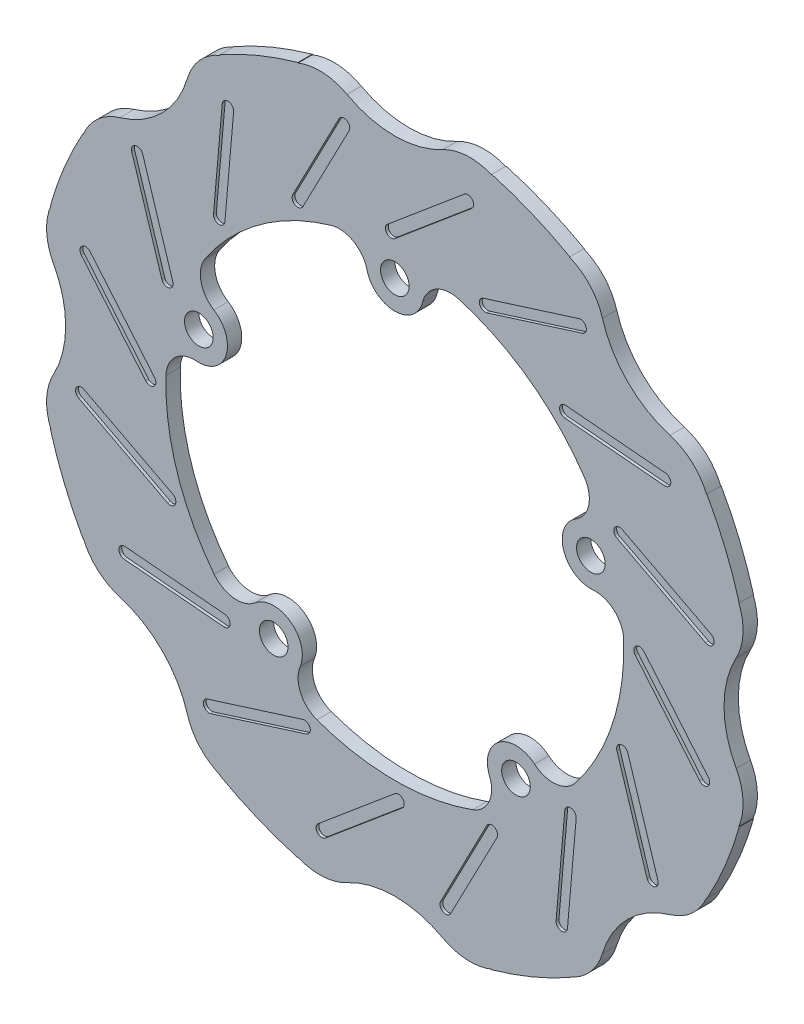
SolidWorks part; units mm, degrees
ref_plane "Front Plane" through (0, 0, 0) normal (0, 0, 1) x (1, 0, 0)
ref_plane "Top Plane" through (0, 0, 0) normal (0, 1, 0) x (1, 0, 0)
ref_plane "Right Plane" through (0, 0, 0) normal (1, 0, 0) x (0, 0, -1)
sketch "Sketch1" plane through (0, 0, 0) normal (0, 0, 1) x (1, 0, 0)
  line L0 (0, 125) -> (0, 0) construction
  line L1 (0, 0) -> (125, 0) construction
  circle A0 centre (0, 0) radius 125
  circle A1 centre (0, 0) radius 80
  dimension "OD" = 250
  dimension "ID" = 160
extrude "Boss-Extrude1" add sketch "Sketch1" against normal blind 5
sketch "Sketch5" plane through (0, 0, 0) normal (0, 0, 1) x (1, 0, 0)
  line L0 (0, 0) -> (0, 125) construction
  line L1 (33.8556, 120.1627) -> (33.8556, 137)
  line L2 (-33.8556, 120.1627) -> (-33.8556, 137)
  line L3 (-33.8556, 137) -> (33.8556, 137)
  circle A0 centre (0, 0) radius 125 construction
  arc A1 (-16.7024, 119.2424) -> (16.7024, 119.2424) centre (0, 150) ccw
  arc A3 (16.7024, 119.2424) -> (33.8556, 120.1627) centre (26.2467, 101.6667) cw
  arc A4 (-16.7024, 119.2424) -> (-33.8556, 120.1627) centre (-26.2467, 101.6667) ccw
  circle A5 centre (0, 0) radius 125 construction
  point P12 (30, 121.3466)
  dimension "D1" = 35
  dimension "D3" = 20
  dimension "D2" = 60
  dimension "D4" = 12
  dimension "D5" = 25
extrude "Cut-Extrude1" cut sketch "Sketch5" against normal through all contours L3 L1 A3 A1 A4 L2
pattern_circular "CirPattern1" [suppressed] count 6 over 360
sketch "Sketch6" plane through (0, 0, 0) normal (0, 0, 1) x (1, 0, 0)
  line L0 (0, 0) -> (0, 80) construction
  circle A0 centre (0, 0) radius 80 construction
  arc A1 (-9.7139, 69.625) -> (9.7139, 69.625) centre (0, 72) ccw
  arc A2 (-22.2031, 76.8571) -> (22.2031, 76.8571) centre (0, 0) ccw construction
  arc A3 (-22.2031, 76.8571) -> (-9.7139, 69.625) centre (-19.4278, 67.25) cw
  arc A4 (22.2031, 76.8571) -> (9.7139, 69.625) centre (19.4278, 67.25) ccw
  arc A5 (22.2031, 76.8571) -> (-22.2031, 76.8571) centre (0, 0) ccw
  dimension "D1" = 8
  dimension "IS_Dia" = 20
  dimension "D2" = 10
extrude "Boss-Extrude2" add sketch "Sketch6" against normal up to surface (5 mm away)
hole_wizard "Ø10.0 (10) Diameter Hole1" positions "Sketch7" profile "Sketch8" hole size "Ø10.0" standard "ANSI Metric"
sketch "Sketch7" plane through (0, 0, 0) normal (0, 0, 1) x (1, 0, 0)
  point P0 (0, 72)
sketch "Sketch8" plane through (0, 72, 0) normal (1, 0, 0) x (0, -1, 0)
  line L0 (0, 0) -> (0, 5)
  line L1 (0, 5) -> (5, 5)
  line L2 (5, 5) -> (5, 0)
  line L5 (5, 0) -> (0, 0)
  line L11 (0, -6.35) -> (0, 107.95) construction
  dimension "Thru Hole Dia." = 10
  dimension "Thru Hole Depth" = 5
sketch "Sketch9" plane through (0, 0, 0) normal (0, 0, 1) x (1, 0, 0)
  arc A0 (26.0924, 85.4387) -> (61.903, 98.4329) centre (32, 125) ccw
  circle A1 centre (0, 72) radius 5 construction
  arc A2 (25.5016, 81.4825) -> (64.8933, 95.7762) centre (32, 125) ccw
  arc A3 (64.8933, 95.7762) -> (61.903, 98.4329) centre (63.3981, 97.1045) ccw
  arc A4 (25.5016, 81.4825) -> (26.0924, 85.4387) centre (25.797, 83.4606) cw
  dimension "D1" = 40
  dimension "D2" = 32
  dimension "D5" = 40
  dimension "D3" = 125
  dimension "D4" = 4
extrude "Cut-Extrude2" [suppressed] cut sketch "Sketch9" against normal blind 1
pattern_circular "CirPattern4" [suppressed] count 6 over 360
sketch "Sketch10" [suppressed] plane through (0, 0, 0) normal (0, 0, 1) x (1, 0, 0)
  line L0 (-60.812, 84.2585) -> (-68.8724, 85.6178) construction
  line L1 (-61.8857, 100.3033) -> (-66.8746, 70.7211) construction
  arc A0 (-61.2454, 82.306) -> (-61.8857, 100.3033) centre (-92.2532, 90.2128) ccw construction
  arc A2 (-66.8746, 70.7211) -> (-65.7065, 72.3445) centre (-92.2532, 90.2128) ccw construction
  arc A3 (-59.3805, 64.0712) -> (-52.3959, 103.4566) centre (-92.2532, 90.2128) ccw
  arc A6 (-59.3805, 64.0712) -> (-52.3959, 103.4566) centre (-92.2532, 90.2128) ccw construction
  circle A9 centre (0, 0) radius 125 construction
  arc A10 (-67.2073, 70.2954) -> (-61.8857, 100.3033) centre (-92.2532, 90.2128) ccw construction
  circle A17 centre (-61.8857, 100.3033) radius 2
  circle A18 centre (-60.812, 84.2585) radius 2
  circle A19 centre (-66.8746, 70.7211) radius 2
  circle A20 centre (-60.2734, 91.3506) radius 2
  arc A21 (-66.8746, 70.7211) -> (-60.812, 84.2585) centre (-92.2532, 90.2128) ccw construction
  circle A22 centre (-63.0481, 77.1336) radius 2
  circle A23 centre (-46.8746, 70.7211) radius 2
  circle A24 centre (-43.0481, 77.1336) radius 2
  circle A25 centre (-40.812, 84.2585) radius 2
  circle A26 centre (-40.2734, 91.3506) radius 2
  circle A27 centre (-41.8857, 100.3033) radius 2
  dimension "D2" = 10
  dimension "D3" = 4
  dimension "D5" = 9.0967
  dimension "D4" = 30
  dimension "D1" = 2
  dimension "D6" = 2
extrude "Cut-Extrude3" [suppressed] cut sketch "Sketch10" against normal through all
pattern_circular "CirPattern5" [suppressed] count 6 over 360
hole_wizard "Ø6.0 (6) Diameter Hole1" positions "Sketch11" profile "Sketch12" hole size "Ø6.0" standard "ANSI Metric"
sketch "Sketch11" plane through (0, 0, 0) normal (0, 0, 1) x (1, 0, 0)
  line L4 (0, 100) -> (29.5649, 100) construction
  line L5 (0, 125) -> (40.0874, 125) construction
  circle A2 centre (0, 0) radius 125 construction
  point P0 (0, 88)
  point P41 (13.339, 100)
  point P89 (0, 112)
  point P115 (20.0437, 125)
  dimension "D1" = 25
  dimension "D4" = 12
  dimension "D6" = 24
sketch "Sketch12" plane through (0, 88, 0) normal (1, 0, 0) x (0, -1, 0)
  line L0 (0, 0) -> (0, 5)
  line L1 (0, 5) -> (3, 5)
  line L2 (3, 5) -> (3, 0)
  line L5 (3, 0) -> (0, 0)
  line L11 (0, -6.35) -> (0, 107.95) construction
  dimension "Thru Hole Dia." = 6
  dimension "Thru Hole Depth" = 5
pattern_circular "CirPattern6" count 8 over 360 about axis through (0, 0, 0) along (0, 0, 1) of "Cut-Extrude1"
pattern_circular "CirPattern7" [suppressed] count 24 over 360
sketch "Sketch13" plane through (0, 0, 0) normal (0, 0, 1) x (1, 0, 0)
  line L0 (0, 115) -> (0, 72) construction
  line L1 (0, 83.9679) -> (26.8116, 106.4655)
  line L2 (-2.5712, 87.0321) -> (24.2404, 109.5297)
  line L3 (0, 93.5) -> (22.9665, 93.5) construction
  arc A0 (-16.7024, 119.2424) -> (16.7024, 119.2424) centre (0, 150) ccw construction
  arc A1 (26.8116, 106.4655) -> (24.2404, 109.5297) centre (25.526, 107.9976) ccw
  arc A2 (0, 83.9679) -> (-2.5712, 87.0321) centre (-1.2856, 85.5) cw
  dimension "D4" = 35
  dimension "D1" = 50
  dimension "D3" = 8
  dimension "D2" = 4
extrude "Cut-Extrude4" cut sketch "Sketch13" against normal blind 1
pattern_circular "CirPattern8" count 16 over 360 about axis through (0, 0, 0) along (0, 0, 1) of "Cut-Extrude4"
pattern_circular "CirPattern11" count 5 over 360 about axis through (0, 0, 0) along (0, 0, 1) of "Boss-Extrude2", "Ø10.0 (10) Diameter Hole1"
